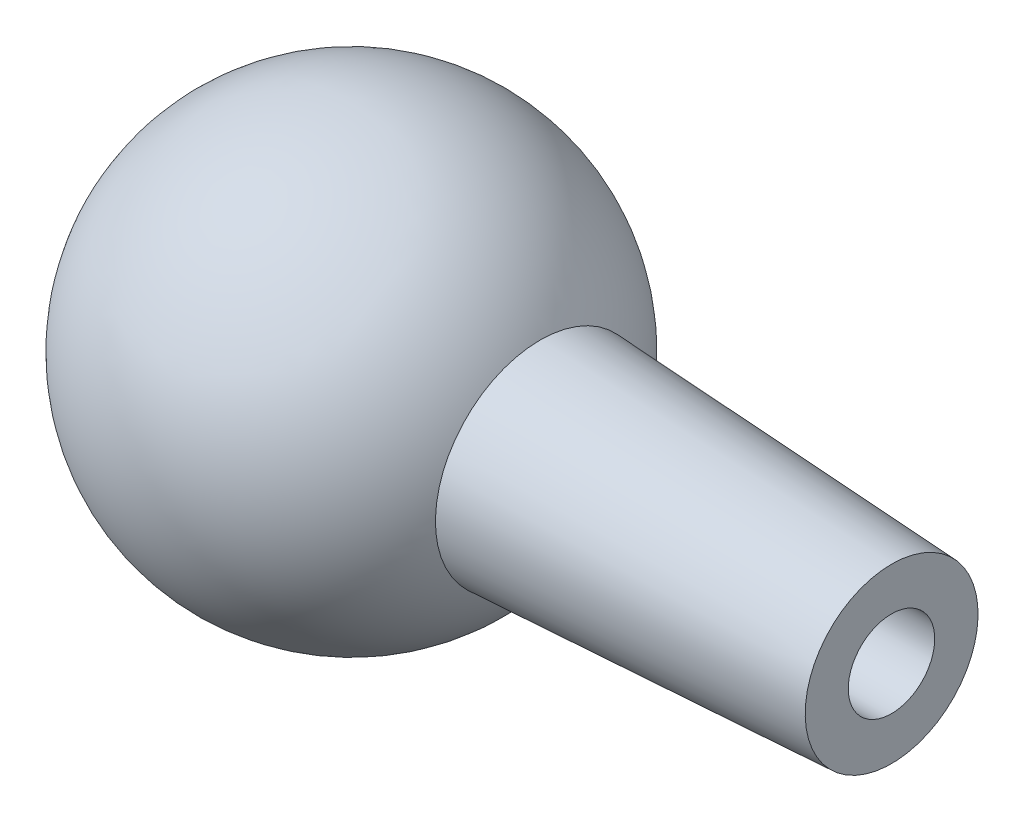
SolidWorks part; units mm, degrees
ref_plane "Front Plane" through (0, 0, 0) normal (0, 0, 1) x (1, 0, 0)
ref_plane "Top Plane" through (0, 0, 0) normal (0, 1, 0) x (1, 0, 0)
ref_plane "Right Plane" through (0, 0, 0) normal (1, 0, 0) x (0, 0, -1)
sketch "Sketch1" plane through (0, 0, 0) normal (0, 0, 1) x (1, 0, 0)
  line L0 (0, 0) -> (-31.75, 0) construction
  line L1 (0, 1.27) -> (-20.2744, 1.27)
  line L2 (0.004, 2.54) -> (-10.3226, 3.0812)
  line L3 (0.004, 2.54) -> (0, 1.27)
  arc A0 (-10.3226, 3.0812) -> (-21.3743, 3.175) centre (-15.875, 0) ccw
  arc A1 (-20.2744, 1.27) -> (-21.3743, 3.175) centre (-20.2744, 2.54) cw
  dimension "D1" = 12.7
  dimension "D6" = 1.27
  dimension "D2" = 1.27
  dimension "D3" = 3
  dimension "D4" = 1.27
  dimension "D5" = 15.875
revolve "Revolve1" add sketch "Sketch1" angle 360 about L0
